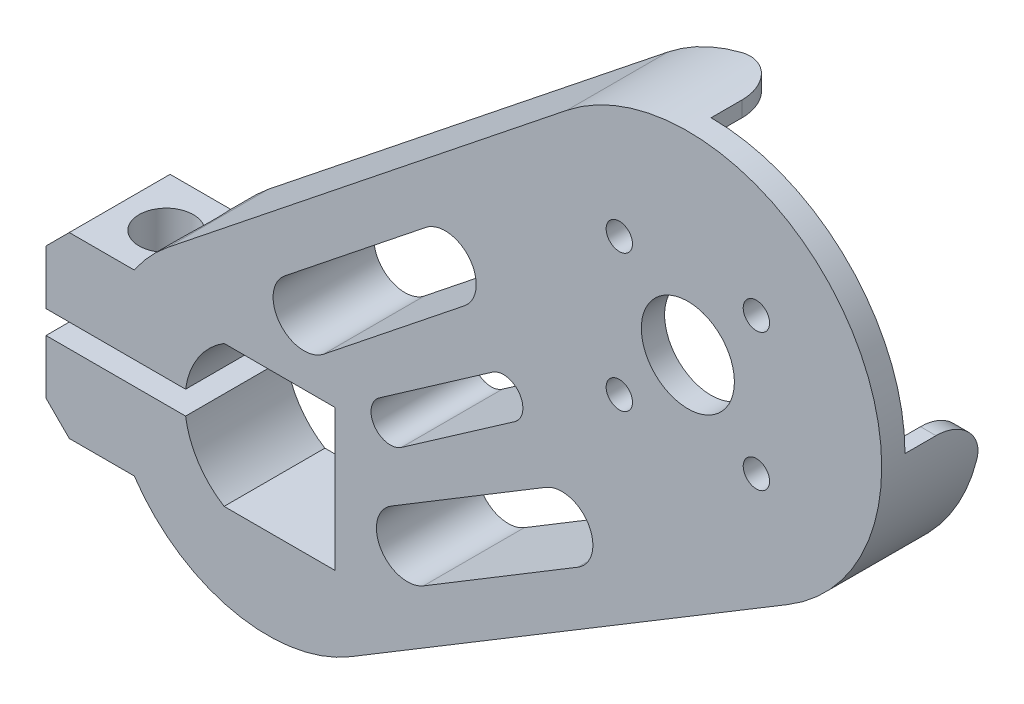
SolidWorks part; units mm, degrees
ref_plane "Plan de face" through (0, 0, 0) normal (0, 0, 1) x (1, 0, 0)
ref_plane "Plan de dessus" through (0, 0, 0) normal (0, 1, 0) x (1, 0, 0)
ref_plane "Plan de droite" through (0, 0, 0) normal (1, 0, 0) x (0, 0, -1)
sketch "Esquisse1" plane through (0, 0, 0) normal (0, 0, 1) x (1, 0, 0)
  line L0 (-35.473, -56.8) -> (-35.473, -18.6) construction
  line L1 (-62.1529, -56.8) -> (-35.473, -56.8) construction
  line L6 (-59.8015, -46.8) -> (-45.473, -46.8)
  line L7 (-45.473, -46.8) -> (-45.473, -28.6)
  line L8 (-45.473, -28.6) -> (-59.8015, -28.6)
  line L9 (-59.8015, -46.8) -> (-45.473, -46.8)
  line L10 (-45.473, -46.8) -> (-45.473, -28.6)
  line L11 (-45.473, -28.6) -> (-59.8015, -28.6)
  line L12 (-67.0789, -21.5158) -> (-15.5869, 19.5461)
  line L13 (12.913, -21.4068) -> (-43.481, -55.4249)
  line L14 (-35.473, -18.6) -> (-62.1529, -18.6) construction
  arc A0 (12.913, -21.4068) -> (-15.5869, 19.5461) centre (0, 0) ccw
  circle A1 centre (-8.8388, 8.8388) radius 1.7
  arc A2 (-67.0789, -21.5158) -> (-43.481, -55.4249) centre (-54.173, -37.7) ccw
  arc A3 (-59.8015, -28.6) -> (-59.8015, -46.8) centre (-54.173, -37.7) ccw
  arc A4 (-59.8015, -28.6) -> (-59.8015, -46.8) centre (-54.173, -37.7) ccw
  arc A5 (-62.1529, -18.6) -> (-62.1529, -56.8) centre (-54.173, -37.7) ccw construction
  circle A6 centre (8.8388, 8.8388) radius 1.7
  circle A7 centre (8.8388, -8.8388) radius 1.7
  circle A8 centre (-8.8388, -8.8388) radius 1.7
  circle A9 centre (0, 0) radius 6
  dimension "D3" = 25
  dimension "D4" = 3.4
  dimension "D5" = 12
  dimension "D1" = 0.1
  dimension "D2" = 10
extrude "Boss.-Extru.1" add sketch "Esquisse1" along normal blind 3
sketch "Esquisse2" plane through (0, 0, 0) normal (0, 0, -1) x (-1, 0, 0)
  line L0 (45.473, -28.6) -> (59.8015, -28.6) construction
  line L1 (45.473, -46.8) -> (45.473, -28.6) construction
  line L2 (59.8015, -46.8) -> (45.473, -46.8) construction
  line L3 (43.481, -55.4249) -> (-12.913, -21.4068) construction
  line L4 (15.5869, 19.5461) -> (67.0789, -21.5158) construction
  line L5 (45.473, -28.6) -> (59.8015, -28.6)
  line L6 (45.473, -46.8) -> (45.473, -28.6)
  line L7 (59.8015, -46.8) -> (45.473, -46.8)
  line L8 (43.481, -55.4249) -> (-12.913, -21.4068)
  line L9 (15.5869, 19.5461) -> (67.0789, -21.5158)
  line L12 (15.5869, 19.5461) -> (-12.913, -21.4068) construction
  line L18 (0, 0) -> (-8.8388, 8.8388) construction
  line L20 (-23, 0) -> (-25, 0)
  line L21 (0, 23) -> (0, 25)
  line L22 (0, 0) -> (0, 23) construction
  line L23 (0, 0) -> (-23, 0) construction
  arc A0 (59.8015, -46.8) -> (59.8015, -28.6) centre (54.173, -37.7) ccw construction
  arc A1 (43.481, -55.4249) -> (67.0789, -21.5158) centre (54.173, -37.7) ccw construction
  arc A2 (59.8015, -46.8) -> (59.8015, -28.6) centre (54.173, -37.7) ccw
  arc A3 (43.481, -55.4249) -> (67.0789, -21.5158) centre (54.173, -37.7) ccw
  arc A7 (-12.913, -21.4068) -> (-12.913, 21.4068) centre (0, 0) cw
  arc A10 (0, 25) -> (15.5869, 19.5461) centre (0, 0) cw
  arc A11 (15.5869, 19.5461) -> (-12.913, -21.4068) centre (0, 0) ccw construction
  arc A12 (-23, 0) -> (0, 23) centre (0, 0) ccw
  arc A14 (-25, 0) -> (-12.913, -21.4068) centre (0, 0) ccw
  point P15 (-19.0713, 12.8563)
  point P16 (-9.0647, 12.8563)
  point P17 (-0.8228, 12.8563)
  point P19 (-9.1808, 0)
  point P20 (-8.8388, 8.8388)
  point P21 (-25, 0)
  dimension "D1" = 46
extrude "Boss.-Extru.6" add sketch "Esquisse2" along normal blind 10 contours A12 L20 L21 M1 M2 M3 M4 M8 M5 M6 M7
sketch "Esquisse5" plane through (0, 0, 3) normal (0, 0, 1) x (1, 0, 0)
  line L0 (-45.473, -37.7) -> (-85.8261, -37.7) construction
  line L1 (-45.473, -46.8) -> (-45.473, -28.6) construction
  line L2 (-74.8185, -36.2) -> (-64.7673, -36.2)
  line L3 (-74.8185, -39.2) -> (-64.7673, -39.2)
  arc A0 (-67.0789, -21.5158) -> (-43.481, -55.4249) centre (-54.173, -37.7) ccw construction
  arc A1 (-59.8015, -28.6) -> (-59.8015, -46.8) centre (-54.173, -37.7) ccw construction
  arc A2 (-74.8185, -36.2) -> (-74.8185, -39.2) centre (-54.173, -37.7) ccw
  arc A3 (-64.7673, -36.2) -> (-64.7673, -39.2) centre (-54.173, -37.7) ccw
  dimension "D1" = 3
extrude "Enlèv. mat.-Extru.1" cut sketch "Esquisse5" against normal through all
sketch "Esquisse6" plane through (0, 0, 3) normal (0, 0, 1) x (1, 0, 0)
  line L0 (-74.8185, -36.2) -> (-82.7673, -36.2)
  line L2 (-64.7673, -36.2) -> (-64.7673, -39.2) construction
  line L3 (-82.7673, -36.2) -> (-82.7673, -26.2)
  line L5 (-82.7673, -26.2) -> (-71.3846, -26.2)
  line L6 (-74.8185, -39.2) -> (-82.7673, -39.2)
  line L7 (-82.7673, -39.2) -> (-82.7673, -49.2)
  line L8 (-82.7673, -49.2) -> (-71.3846, -49.2)
  arc A1 (-67.0789, -21.5158) -> (-74.8185, -36.2) centre (-54.173, -37.7) ccw construction
  arc A2 (-71.3846, -26.2) -> (-74.8185, -36.2) centre (-54.173, -37.7) ccw
  arc A3 (-74.8185, -39.2) -> (-43.481, -55.4249) centre (-54.173, -37.7) ccw construction
  arc A4 (-74.8185, -39.2) -> (-71.3846, -49.2) centre (-54.173, -37.7) ccw
  dimension "D1" = 18
  dimension "D2" = 10
extrude "Boss.-Extru.7" add sketch "Esquisse6" against normal up to surface (13 mm away)
sketch "Esquisse7" plane through (0, -49.2, 0) normal (0, -1, 0) x (-1, 0, 0)
  line L0 (64.7673, 10) -> (82.7673, -3) construction
  circle A0 centre (73.7673, 3.5) radius 6
  dimension "D1" = 12
extrude "Enlèv. mat.-Extru.2" cut sketch "Esquisse7" along normal blind 10
sketch "Esquisse9" plane through (0, -49.2, 0) normal (0, -1, 0) x (1, 0, 0)
  circle A0 centre (-73.7673, -3.5) radius 3.5
  dimension "D1" = 7
extrude "Enlèv. mat.-Extru.3" cut sketch "Esquisse9" against normal through all
sketch "Esquisse10" plane through (0, -26.2, 0) normal (0, 1, 0) x (1, 0, 0)
  circle A0 centre (-73.7673, 3.5) radius 6
  dimension "D1" = 12
extrude "Enlèv. mat.-Extru.4" cut sketch "Esquisse10" along normal through all
chamfer "Chanfrein1" distance 3 angle 45 2 edges at (-82.7673, -49.2, -3.5) (-82.7673, -26.2, -3.5)
sketch "Esquisse11" plane through (0, 0, -10) normal (0, 0, -1) x (-1, 0, 0)
  line L0 (15.5869, 19.5461) -> (-12.913, -21.4068) construction
  line L1 (43.481, -55.4249) -> (67.7673, -22.0896) construction
  line L2 (55.6241, -38.7572) -> (1.3369, -0.9304) construction
  line L4 (31.2909, -5.7673) -> (49.4842, -20.2754) construction
  line L5 (60.8441, -29.3343) -> (9.3521, 11.7276)
  line L6 (61.8847, -30.164) -> (9.8626, 11.3206) construction
  line L7 (33.7848, -2.6399) -> (51.9781, -17.148)
  line L8 (28.797, -8.8947) -> (46.9903, -23.4027)
  line L9 (23.776, -16.5658) -> (38.3574, -26.7259) construction
  line L10 (25.2053, -14.5146) -> (39.7866, -24.6747)
  line L11 (22.3468, -18.6169) -> (36.9281, -28.7771)
  line L12 (31.2909, -5.7673) -> (23.776, -16.5658) construction
  line L13 (16.2485, -27.3554) -> (36.1596, -39.3981) construction
  line L14 (14.1784, -30.7781) -> (34.0895, -42.8208)
  line L15 (18.3186, -23.9328) -> (38.2297, -35.9755)
  arc A1 (33.7848, -2.6399) -> (28.797, -8.8947) centre (31.2909, -5.7673) ccw
  arc A2 (46.9903, -23.4027) -> (51.9781, -17.148) centre (49.4842, -20.2754) ccw
  arc A3 (25.2053, -14.5146) -> (22.3468, -18.6169) centre (23.776, -16.5658) ccw
  arc A4 (36.9281, -28.7771) -> (39.7866, -24.6747) centre (38.3574, -26.7259) ccw
  arc A5 (14.1784, -30.7781) -> (18.3186, -23.9328) centre (16.2485, -27.3554) cw
  arc A6 (38.2297, -35.9755) -> (34.0895, -42.8208) centre (36.1596, -39.3981) cw
  point P11 (40.3875, -13.0213)
  point P23 (31.0667, -21.6458)
  point P35 (26.204, -33.3768)
  dimension "D2" = 4
  dimension "D3" = 2.5
  dimension "D1" = 10
extrude "Enlèv. mat.-Extru.5" cut sketch "Esquisse11" against normal through all
fillet "Congé1" radius 6 2 edges at (24, 0, -10) (0, 24, -10)
